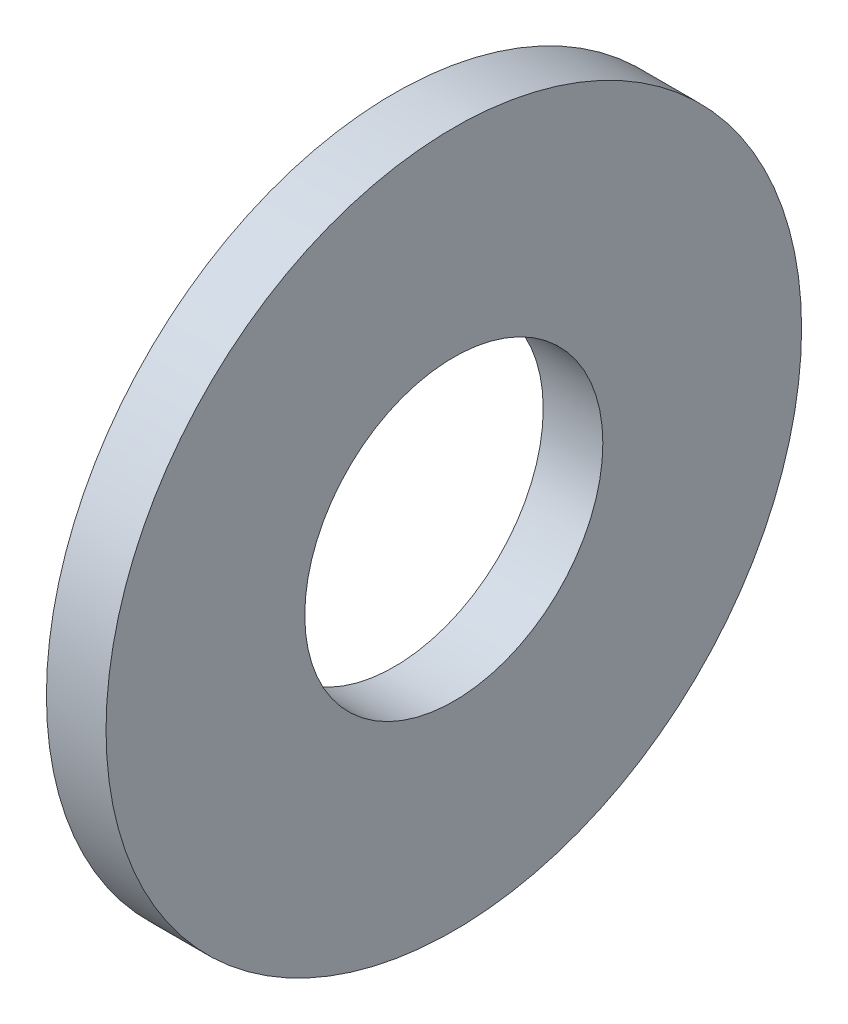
SolidWorks part; units mm, degrees
ref_plane "Front Plane" through (0, 0, 0) normal (0, 0, 1) x (1, 0, 0)
ref_plane "Top Plane" through (0, 0, 0) normal (0, 1, 0) x (1, 0, 0)
ref_plane "Right Plane" through (0, 0, 0) normal (1, 0, 0) x (0, 0, -1)
sketch "Sketch1" plane through (0, 0, 0) normal (1, 0, 0) x (0, 0, -1)
  circle A0 centre (0, 0) radius 4.7625
  circle A1 centre (0, 0) radius 11.1125
  dimension "D1" = 6.35
  dimension "D2" = 9.525
extrude "Boss-Extrude1" add sketch "Sketch1" along normal blind 1.905
